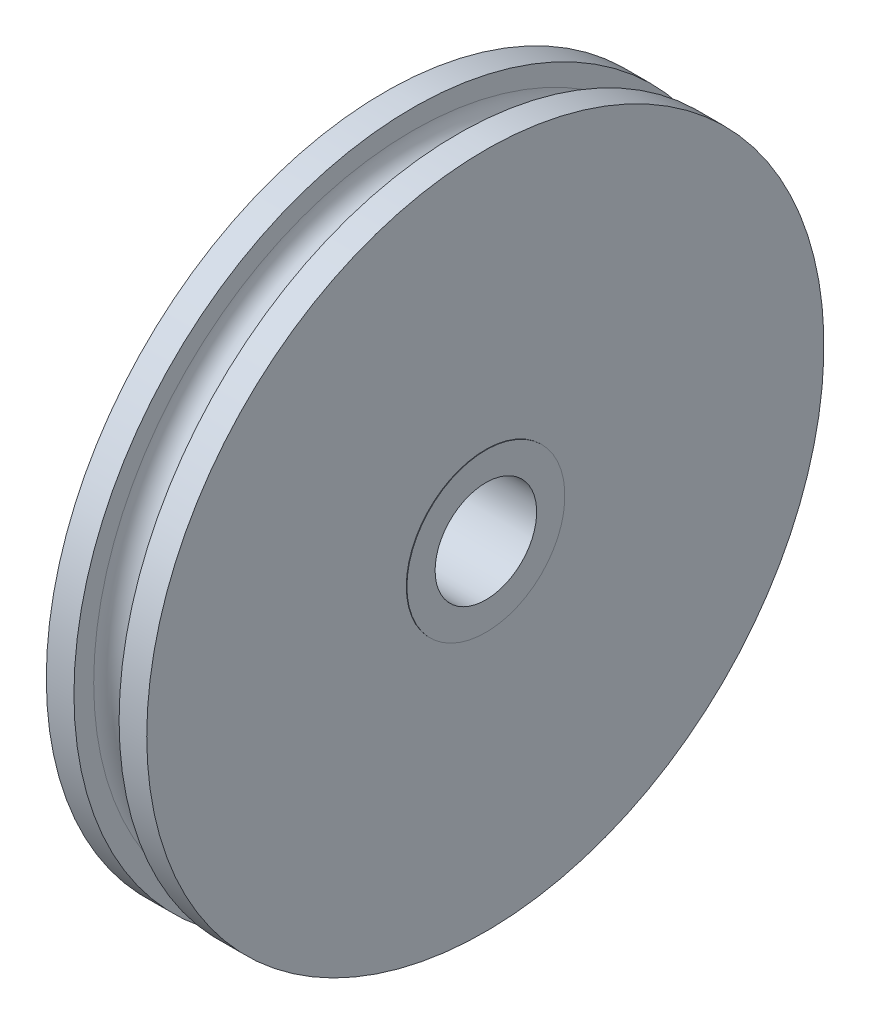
SolidWorks part; units mm, degrees
ref_plane "Plan de face" through (0, 0, 0) normal (0, 0, 1) x (1, 0, 0)
ref_plane "Plan de dessus" through (0, 0, 0) normal (0, 1, 0) x (1, 0, 0)
ref_plane "Plan de droite" through (0, 0, 0) normal (1, 0, 0) x (0, 0, -1)
sketch "Esquisse1" plane through (0, 0, 0) normal (0, 1, 0) x (1, 0, 0)
  line L0 (-12.5, 0) -> (12.5, 0) construction
  line L1 (0, 0) -> (0, 52.5) construction
  line L2 (9, 9) -> (-9, 9)
  line L3 (-9, 9) -> (-9, 14)
  line L4 (-9, 14) -> (-8.9, 14)
  line L5 (-8.9, 14) -> (-8.9, 60)
  line L6 (-4, 60) -> (-4, 56.5)
  line L7 (4, 60) -> (4, 56.5)
  line L8 (8.9, 14) -> (8.9, 60)
  line L9 (9, 14) -> (8.9, 14)
  line L10 (9, 9) -> (9, 14)
  line L11 (8.9, 60) -> (4, 60)
  line L12 (-4, 60) -> (-8.9, 60)
  arc A1 (-4, 56.5) -> (4, 56.5) centre (0, 56.5) ccw
  point P21 (0, 9)
  dimension "D7" = 120
  dimension "D8" = 3.5
  dimension "D1" = 18
  dimension "D2" = 18
  dimension "D3" = 17.8
  dimension "D4" = 5
  dimension "D5" = 105
  dimension "D6" = 8
revolve "Révolution1" add sketch "Esquisse1" angle 360 about L0
